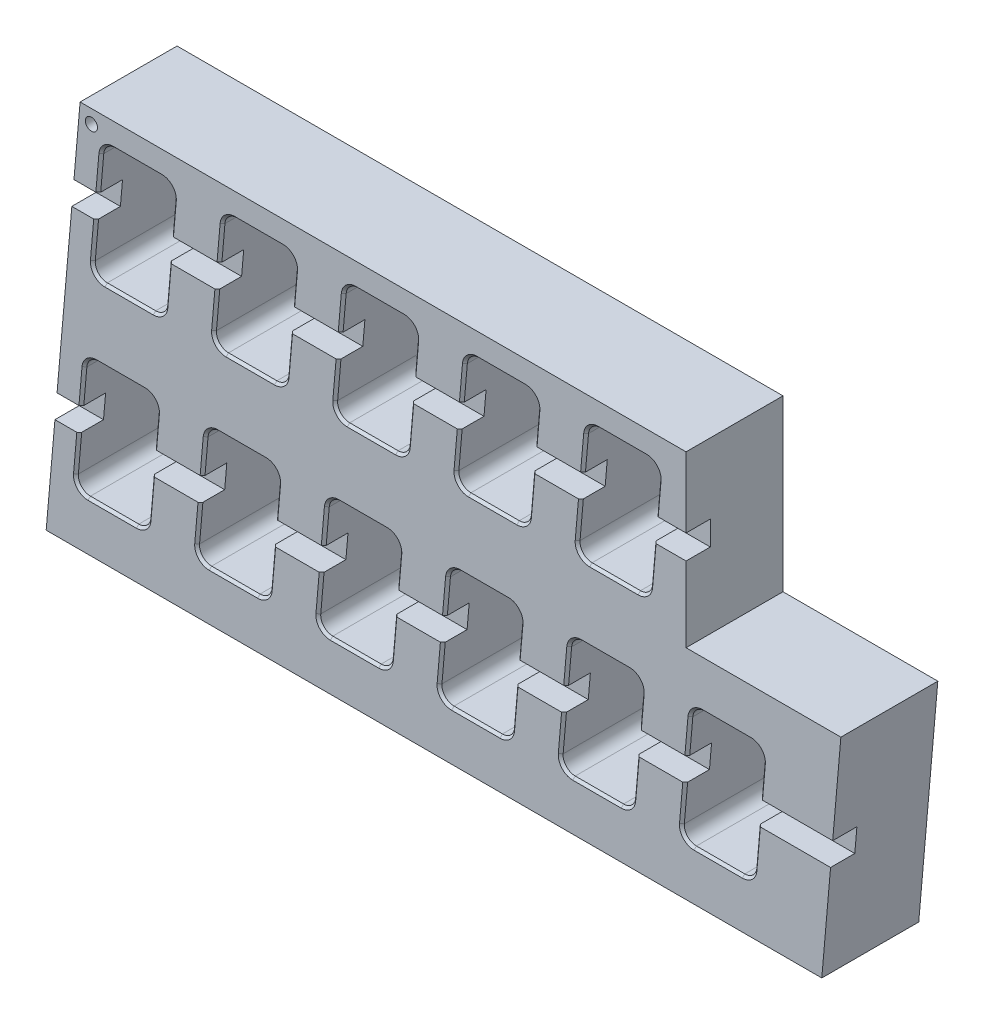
SolidWorks part; units mm, degrees
ref_plane "Front" through (0, 0, 0) normal (0, 0, 1) x (1, 0, 0)
ref_plane "Top" through (0, 0, 0) normal (0, 1, 0) x (1, 0, 0)
ref_plane "Right" through (0, 0, 0) normal (1, 0, 0) x (0, 0, -1)
sketch "Sketch1" plane through (0, 0, 0) normal (0, 0, 1) x (1, 0, 0)
  line L0 (0, 0) -> (160, 0)
  line L1 (0, 0) -> (6.9991, 80)
  line L2 (6.9991, 80) -> (166.9991, 80)
  line L6 (160, 0) -> (166.9991, 80)
  dimension "D1" = 85
  dimension "D2" = 160
  dimension "D3" = 80
extrude "Extrude1" add sketch "Sketch1" along normal blind 20
sketch "Sketch2" plane through (0, 0, 20) normal (0, 0, 1) x (1, 0, 0)
  line L0 (11.3811, 72.7179) -> (9.6313, 52.7179)
  line L1 (13.8716, 75) -> (23.8525, 75)
  line L2 (6.9991, 80) -> (0, 0) construction
  line L3 (166.9991, 80) -> (6.9991, 80) construction
  line L4 (26.343, 72.2821) -> (24.5932, 52.2821)
  line L5 (12.1218, 50) -> (22.1027, 50)
  arc A0 (11.3811, 72.7179) -> (13.8716, 75) centre (13.8716, 72.5) cw
  arc A1 (9.6313, 52.7179) -> (12.1218, 50) centre (12.1218, 52.5) ccw
  arc A2 (22.1027, 50) -> (24.5932, 52.2821) centre (22.1027, 52.5) ccw
  arc A3 (26.343, 72.2821) -> (23.8525, 75) centre (23.8525, 72.5) ccw
  point P9 (11.5807, 75)
  point P17 (26.5807, 75)
  dimension "D5" = 2.5
  dimension "D1" = 5
  dimension "D2" = 5
  dimension "D3" = 15
  dimension "D4" = 25
extrude "Cut-Extrude1" cut sketch "Sketch2" against normal blind 20
chamfer "Chamfer1" distance 0.5 angle 45 8 edges at (25.4681, 62.2821, 20) (25.6957, 74.189, 20) (18.862, 75, 20) (12.1826, 74.3432, 20) (10.5062, 62.7179, 20) (10.2786, 50.811, 20) (17.1123, 50, 20) (23.7917, 50.6568, 20)
pattern_linear "LPattern2" count 6 spacing 25 along (1, 0, 0) count 2 spacing 40 along (-0.0872, -0.9962, 0) of "Cut-Extrude1", "Chamfer1"
sketch "Sketch3" plane through (0, 0, 20) normal (0, 0, 1) x (1, 0, 0)
  line L1 (3.2854, 60.5) -> (167.3007, 60.5)
  line L3 (3.7229, 65.5) -> (167.7381, 65.5)
  line L5 (-0.2008, 20.6522) -> (163.8145, 20.6522)
  line L7 (0.2366, 25.6522) -> (164.2519, 25.6522)
  line L10 (5.0067, 80.1743) -> (-1.9924, 0.1743)
  line L11 (3.7229, 65.5) -> (3.2854, 60.5)
  line L12 (13.8716, 75.5) -> (23.8525, 75.5) construction
  line L13 (10.3853, 35.6522) -> (20.3662, 35.6522) construction
  line L14 (167.3007, 60.5) -> (167.7381, 65.5)
  line L15 (161.9924, -0.1743) -> (168.9915, 79.8257)
  line L16 (163.8145, 20.6522) -> (164.2519, 25.6522)
  line L17 (0.2366, 25.6522) -> (-0.2008, 20.6522)
  dimension "D1" = 10
  dimension "D2" = 5
  dimension "D3" = 10
  dimension "D4" = 5
  dimension "D5" = 2
  dimension "D6" = 2
extrude "Cut-Extrude2" cut sketch "Sketch3" against normal blind 5
sketch "Sketch6" plane through (0, 0, 20) normal (0, 0, 1) x (1, 0, 0)
  circle A0 centre (9.3384, 77.1989) radius 1.25
  dimension "D1" = 2.5
extrude "Cut-Extrude5" cut sketch "Sketch6" against normal blind 10
sketch "Sketch7" plane through (0, 0, 20) normal (0, 0, 1) x (1, 0, 0)
  line L0 (166.9991, 80) -> (6.9991, 80) construction
  line L1 (131.9991, 88.4657) -> (172.9873, 88.4657)
  line L2 (131.9991, 88.4657) -> (131.9991, 45)
  line L3 (131.9991, 45) -> (172.9873, 45)
  line L4 (172.9873, 88.4657) -> (172.9873, 45)
  dimension "D1" = 125
  dimension "D2" = 35
extrude "Cut-Extrude6" cut sketch "Sketch7" against normal through all
sketch "Sketch Pattern" plane through (0, 0, 20) normal (0, 0, 1) x (1, 0, 0)
  point P0 (135.3853, 35.1522)
  point P1 (110.3853, 35.1522)
  point P3 (85.3853, 35.1522)
  point P5 (60.3853, 35.1522)
  point P7 (35.3853, 35.1522)
  point P9 (10.3853, 35.1522)
  point P11 (13.8716, 75)
  point P13 (38.8164, 74.8613)
  point P15 (63.8716, 75)
  point P16 (88.8716, 75)
  point P18 (113.8716, 75)
